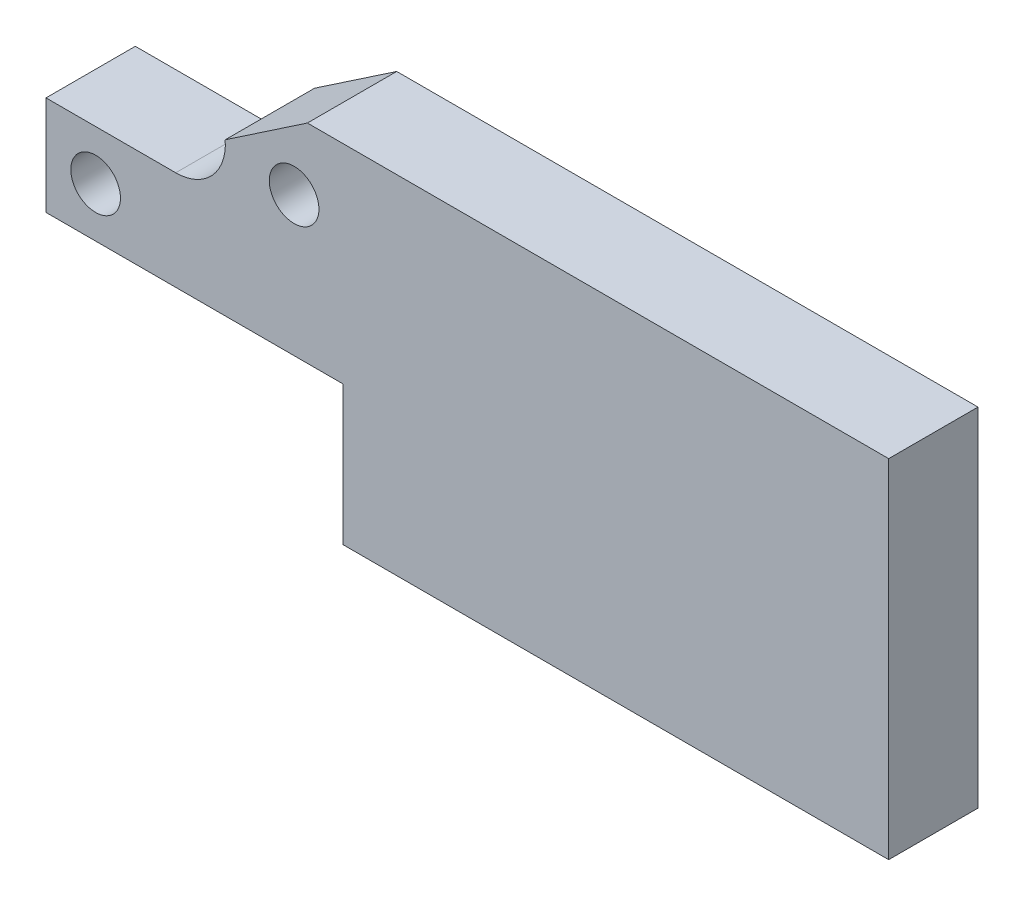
SolidWorks part; units mm, degrees
ref_plane "Front Plane" through (0, 0, 0) normal (0, 0, 1) x (1, 0, 0)
ref_plane "Top Plane" through (0, 0, 0) normal (0, 1, 0) x (1, 0, 0)
ref_plane "Right Plane" through (0, 0, 0) normal (1, 0, 0) x (0, 0, -1)
sketch "Sketch1" plane through (0, 0, 0) normal (0, 0, 1) x (1, 0, 0)
  line L0 (-0.7145, 7) -> (0, 7)
  line L1 (0, 0) -> (11, 0)
  line L2 (0, 0) -> (0, 2.805)
  line L3 (0, 7) -> (11, 7)
  line L4 (11, 0) -> (11, 7)
  line L5 (-2.3709, 5.8792) -> (-1.6441, 4.805)
  line L8 (0.4063, 5.3436) -> (-0.7145, 7)
  line L9 (-0.7145, 7) -> (-2.3709, 5.8792)
  line L10 (-2.3709, 5.8792) -> (-1.2501, 4.2228)
  line L11 (-1.2501, 4.2228) -> (0.4063, 5.3436)
  line L13 (-0.7145, 7) -> (-2.3709, 5.8792)
  line L27 (-5.9823, 3.805) -> (-4.9823, 3.805) construction
  line L28 (-1.6441, 4.805) -> (-5.9823, 4.805)
  line L30 (0, 2.805) -> (-5.9823, 2.805)
  line L31 (-5.9823, 4.805) -> (-5.9823, 2.805)
  circle A0 centre (-0.9823, 5.6114) radius 0.5
  circle A1 centre (-4.9823, 3.805) radius 0.5
  dimension "D4" = 1
  dimension "D5" = 1
  dimension "D6" = 1
  dimension "D8" = 1
  dimension "D9" = 4
  dimension "D1" = 11
  dimension "D2" = 7
  dimension "D7" = 2
  dimension "D10" = 1
  dimension "D3" = 0
extrude "Extrude1" add sketch "Sketch1" along normal blind 1.8
fillet "Fillet1" radius 1 1 edges at (-1.6441, 4.805, 0.9)
